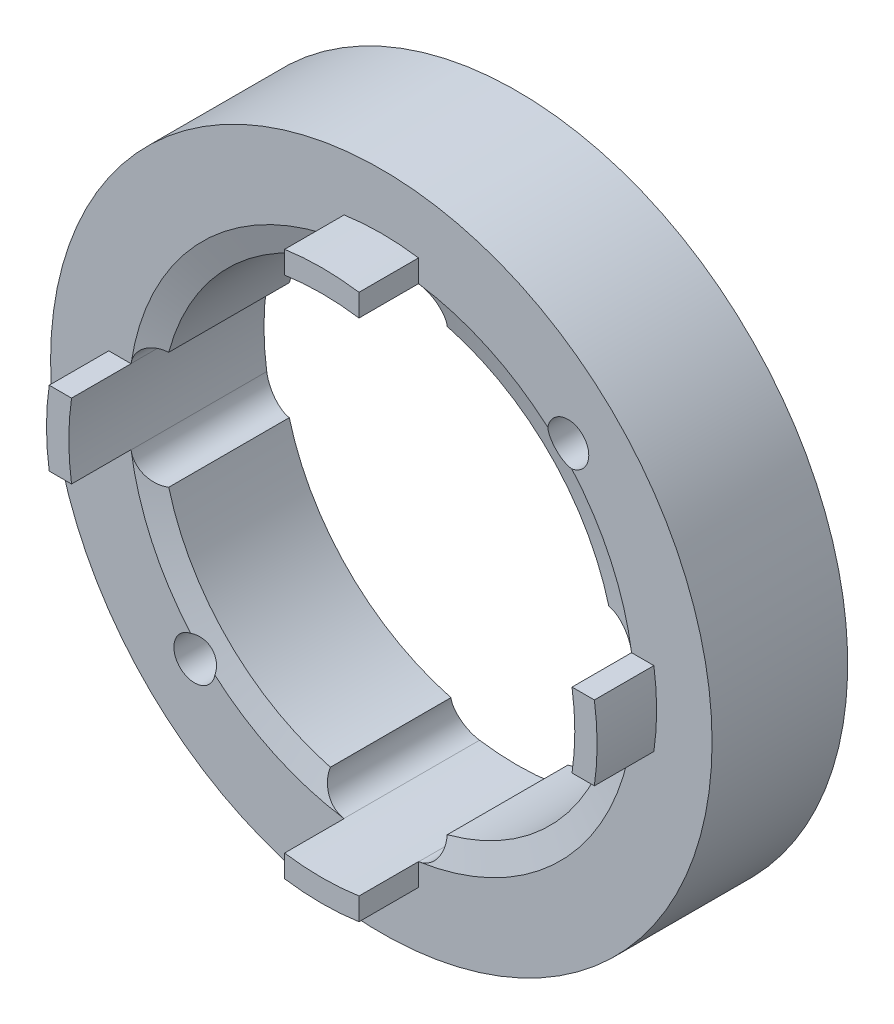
SolidWorks part; units mm, degrees
ref_plane "Front Plane" through (0, 0, 0) normal (0, 0, 1) x (1, 0, 0)
ref_plane "Top Plane" through (0, 0, 0) normal (0, 1, 0) x (1, 0, 0)
ref_plane "Right Plane" through (0, 0, 0) normal (1, 0, 0) x (0, 0, -1)
sketch "Sketch1" plane through (0, 0, 0) normal (0, 0, 1) x (1, 0, 0)
  circle A0 centre (0, 0) radius 22.225
  dimension "D1" = 44.45
extrude "Boss-Extrude1" add sketch "Sketch1" along normal blind 9.5
sketch "Sketch2" plane through (0, 0, 9.5) normal (0, 0, 1) x (1, 0, 0)
  circle A0 centre (0, 0) radius 15.3
  dimension "D1" = 30.6
extrude "Cut-Extrude1" cut sketch "Sketch2" against normal up to next
sketch "Sketch3" plane through (0, 0, 0) normal (0, 1, 0) x (1, 0, 0)
  line L0 (22.4, -4.75) -> (-21.8017, -4.75) construction
  line L1 (15.3, 0) -> (-15.3, 0) construction
  line L2 (-15.3, -9.5) -> (15.3, -9.5) construction
  line L3 (0, 0) -> (0, -9.5) construction
  line L4 (-16, -0.6867) -> (-16, -9.2037) construction
  line L5 (-15, -0.9869) -> (-17, -0.3865)
  line L6 (-22.225, -9.5) -> (22.225, -9.5) construction
  line L8 (-17, -0.3865) -> (-22.225, -0.3865)
  line L9 (-15, 0) -> (-15, -0.9869)
  line L10 (-15, -8.9075) -> (-17, -9.5)
  line L11 (-22.225, 0) -> (-22.225, -9.5) construction
  line L13 (-22.225, -0.3865) -> (-22.225, 0)
  line L14 (-15, -9.5) -> (-15, -8.9075)
  line L15 (-22.225, 0) -> (-15, 0)
  line L16 (-17, -9.5) -> (-15, -9.5)
  point P11 (-16, -4.75)
  dimension "D1" = 8.517
  dimension "D2" = 16
  dimension "D3" = 73.29
  dimension "D4" = 17
  dimension "D5" = 15
  dimension "D6" = 73.497
revolve "Cut-Revolve1" cut sketch "Sketch3" angle 360 about L3
sketch "Sketch5" plane through (0, 0, 9.5) normal (0, 0, 1) x (1, 0, 0)
  line L0 (0, 0) -> (-50000, 0) construction
  line L1 (-18.3152, 2.5) -> (-16.8152, 2.5)
  line L2 (-18.3152, -2.5) -> (-16.8152, -2.5)
  arc A0 (-16.8152, -2.5) -> (-16.8152, 2.5) centre (0, 0) cw
  arc A1 (-18.3152, -2.5) -> (-18.3152, 2.5) centre (-1.5, 0) cw
  dimension "D1" = 5
  dimension "D2" = 17
  dimension "D3" = 1.5
extrude "Boss-Extrude2" add sketch "Sketch5" along normal blind 4 and the other way up to next (9.1135 mm away)
sketch "Sketch6" plane through (0, 0, 9.5) normal (0, 0, 1) x (1, 0, 0)
  line L0 (0, 0) -> (-15.1319, 2.2615) construction
  line L2 (0, 0) -> (-15.1319, -2.2615) construction
  line L3 (0, 0) -> (-15.3, 0) construction
  arc A0 (-15.1319, -2.2615) -> (-15.1319, 2.2615) centre (0, 0) cw construction
  arc A3 (-16.8133, 2.5128) -> (-16.8133, -2.5128) centre (0, 0) ccw
  arc A4 (-13.4506, 2.0102) -> (-13.4506, -2.0102) centre (0, 0) ccw
  arc A5 (-13.4506, 2.0102) -> (-16.8133, 2.5128) centre (-15.1319, 2.2615) ccw
  arc A6 (-16.8133, -2.5128) -> (-13.4506, -2.0102) centre (-15.1319, -2.2615) ccw
  arc A7 (-16.8152, 2.5) -> (-16.8152, -2.5) centre (0, 0) ccw construction
  circle A8 centre (0, 0) radius 15.3 construction
  point P3 (-15.3, 0)
  dimension "D1" = 17
extrude "Cut-Extrude3" cut sketch "Sketch6" against normal through all
pattern_circular "CirPattern1" count 4 over 360 about axis through (0, 0, 0) along (0, 0, 1) of "Boss-Extrude2", "Cut-Extrude3"
hole_wizard "7/64 (0.10938) Diameter Hole1" positions "Sketch8" profile "Sketch7" hole size "7/64" standard "ANSI Inch"
sketch "Sketch8" plane through (0, 0, 9.5) normal (0, 0, 1) x (1, 0, 0)
  line L0 (12.5511, 12.5511) -> (-12.5511, -12.5511) construction
  line L3 (0, 0) -> (9.0209, 0) construction
  point P0 (-12.5511, -12.5511)
  point P2 (12.5511, 12.5511)
  dimension "D1" = 45
  dimension "D2" = 35.5
sketch "Sketch7" plane through (-12.5511, -12.5511, 9.5) normal (1, 0, 0) x (0, -1, 0)
  line L0 (0, 0) -> (0, 9.1135)
  line L1 (0, 9.1135) -> (1.3891, 9.1135)
  line L2 (1.3891, 9.1135) -> (1.3891, 0)
  line L5 (1.3891, 0) -> (0, 0)
  line L11 (0, -6.35) -> (0, 107.95) construction
  dimension "Thru Hole Dia." = 2.7783
  dimension "Thru Hole Depth" = 9.1135
